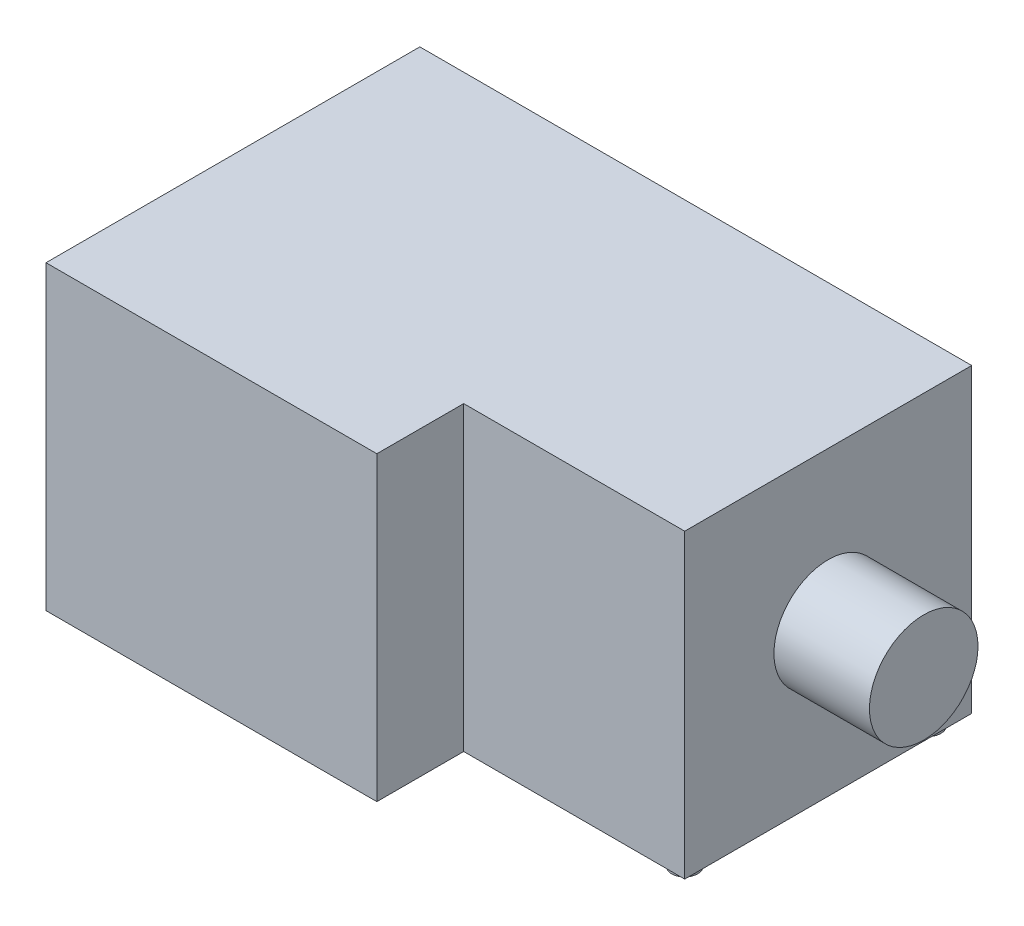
SolidWorks part; units mm, degrees
ref_plane "Front Plane" through (0, 0, 0) normal (0, 0, 1) x (1, 0, 0)
ref_plane "Top Plane" through (0, 0, 0) normal (0, 1, 0) x (1, 0, 0)
ref_plane "Right Plane" through (0, 0, 0) normal (1, 0, 0) x (0, 0, -1)
sketch "Sketch1" plane through (0, 0, 0) normal (0, 1, 0) x (1, 0, 0)
  line L0 (0, 0) -> (0, -200)
  line L1 (0, 0) -> (1271, 0)
  line L2 (0, 0) -> (0, 661)
  line L3 (0, 661) -> (1271, 661)
  line L4 (1271, 0) -> (1271, 661)
  line L5 (0, -200) -> (762, -200)
  line L6 (762, -200) -> (762, 0)
  dimension "D1" = 1271
  dimension "D2" = 661
  dimension "D3" = 861
  dimension "D4" = 762
extrude "Boss-Extrude1" add sketch "Sketch1" along normal blind 694 contours L1 L4 L3 L2 | L5 L6 L1 L0
sketch "Sketch2" plane through (0, 0, -661) normal (0, 0, -1) x (-1, 0, 0)
  line L0 (-1220.5, 67) -> (-1220.5, 627) construction
  line L1 (-1271, 347) -> (-1220.5, 347) construction
  line L2 (-1271, 694) -> (-1271, 0) construction
  line L3 (-50.5, 67) -> (-50.5, 627) construction
  line L4 (-50.5, 347) -> (0, 347) construction
  line L5 (0, 694) -> (0, 0) construction
  circle A0 centre (-1220.5, 67) radius 6.35
  circle A1 centre (-1220.5, 627) radius 6.35
  circle A2 centre (-50.5, 627) radius 6.35
  circle A3 centre (-50.5, 67) radius 6.35
  point P0 (-1220.5, 67)
  point P1 (-1220.5, 627)
  point P2 (-50.5, 627)
  point P3 (-50.5, 67)
  dimension "D3" = 12.7
  dimension "D1" = 560
  dimension "D2" = 1170
extrude "Boss-Extrude2" [suppressed] add sketch "Sketch2" along normal blind 12.7
sketch "Sketch3" plane through (1271, 0, 0) normal (1, 0, 0) x (0, 0, -1)
  line L0 (661, 694) -> (0, 0) construction
  circle A0 centre (330.5, 347) radius 125
  dimension "D1" = 250
extrude "Boss-Extrude3" add sketch "Sketch3" along normal blind 220
sketch "Sketch4" plane through (0, 0, 0) normal (0, -1, 0) x (1, 0, 0)
  line L0 (0, 200) -> (0, -661) construction
  line L1 (50.5, -50.5) -> (1220.5, -50.5) construction
  line L2 (50.5, -50.5) -> (50.5, -610.5) construction
  line L3 (50.5, -610.5) -> (1220.5, -610.5) construction
  line L4 (1220.5, -50.5) -> (1220.5, -610.5) construction
  line L5 (0, -661) -> (1271, -661) construction
  circle A0 centre (50.5, -50.5) radius 30
  circle A1 centre (50.5, -610.5) radius 30
  circle A2 centre (1220.5, -610.5) radius 30
  circle A3 centre (1220.5, -50.5) radius 30
  circle A4 centre (50.5, -50.5) radius 5
  circle A5 centre (50.5, -610.5) radius 5
  circle A6 centre (1220.5, -610.5) radius 5
  circle A7 centre (1220.5, -50.5) radius 5
  dimension "D5" = 60
  dimension "D6" = 10
  dimension "D1" = 560
  dimension "D2" = 1170
  dimension "D3" = 50.5
  dimension "D4" = 50.5
extrude "Boss-Extrude4" add sketch "Sketch4" along normal blind 25
ref_point "Point1"
ref_plane "Plane1" through (0, 0, -610.5) normal (0, 0, 1) x (1, 0, 0)
